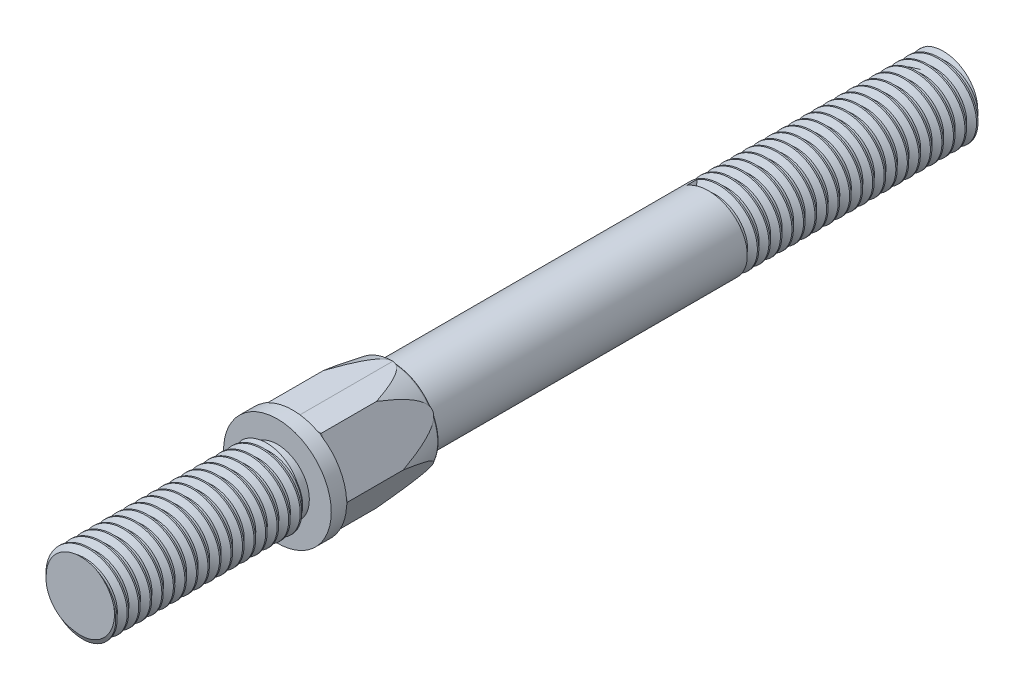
SolidWorks part; units mm, degrees
ref_plane "Front Plane" through (0, 0, 0) normal (0, 0, 1) x (1, 0, 0)
ref_plane "Top Plane" through (0, 0, 0) normal (0, 1, 0) x (1, 0, 0)
ref_plane "Right Plane" through (0, 0, 0) normal (1, 0, 0) x (0, 0, -1)
sketch "Sketch1" plane through (0, 0, 0) normal (1, 0, 0) x (0, 0, -1)
  line L0 (0, 0) -> (113, 0) construction
  line L6 (35, 7) -> (26, 7)
  line L7 (26, 7) -> (26, 4.9)
  line L8 (26, 4.9) -> (0, 4.9) construction
  line L9 (0, 4.9) -> (0, 0)
  line L10 (0, 0) -> (104, 0) construction
  line L11 (35, 7) -> (37, 7) construction
  line L12 (37, 7) -> (37, 6) construction
  line L14 (41, 4.9) -> (113, 4.9)
  line L17 (113, 4.9) -> (113, 0)
  line L21 (37, 6) -> (41, 6) construction
  line L23 (41, 4.9) -> (41, 6)
  line L24 (35, 7) -> (41, 6)
  line L25 (0, 0) -> (113, 0)
  line L26 (26, 4.9) -> (26, 4.15)
  line L27 (26, 4.15) -> (25, 4.15)
  line L28 (25, 4.15) -> (25, 4.9)
  line L29 (25, 4.9) -> (0, 4.9)
revolve "Revolve1" add sketch "Sketch1" angle 360 about L0
sketch "Sketch8" plane through (0, 0, -41) normal (0, 0, -1) x (-1, 0, 0)
  line L1 (-3.4641, 6) -> (-6.9282, 0)
  line L2 (-6.9282, 0) -> (-3.4641, -6)
  line L3 (-3.4641, -6) -> (3.4641, -6)
  line L4 (3.4641, -6) -> (6.9282, 0)
  line L5 (6.9282, 0) -> (3.4641, 6)
  line L6 (3.4641, 6) -> (-3.4641, 6)
  circle A1 centre (0, 0) radius 7 construction
  circle A2 centre (0, 0) radius 6 construction
  dimension "D1" = 12
extrude "Cut-Extrude1" cut sketch "Sketch8" against normal blind 13 flip side to cut
fillet "Fillet1" radius 0.25 13 edges at (-4.3301, 4.5, -28) (-6.0622, 1.5, -28) (-5.1962, -3, -28) (0, -6, -28) (5.1962, -3, -28) (-1.7321, 6, -28) (1.7321, 6, -28) (5.1962, 3, -28) (-3, -5.1962, -41) (-6, 0, -41) (6, 0, -41) (3, 5.1962, -41) (3, -5.1962, -41)
thread "Thread1" pitch 1.5 start angle 0, offset 2, length 32, pitch 1.5, diameter 9.8
ref_plane "Plane1" through (4.9, 0, -115) normal (0, -1, 0) x (1, 0, 0)
sketch "Thread Profile1" plane through (4.9, 0, -115) normal (0, -1, 0) x (1, 0, 0)
  line L0 (0, 0) -> (0, 1.5) construction
  line L11 (0, 0) -> (0, 1.3125)
  line L12 (0, 1.3125) -> (-0.8119, 0.8437)
  line L13 (-0.8119, 0.8437) -> (-0.8119, 0.4687)
  line L15 (-0.8119, 0.4687) -> (0, 0)
  line L17 (-0.8119, 0.6562) -> (0, 0.6562) construction
  point P2 (0, 0)
  dimension "Pitch" = 1.5
  dimension "Profile_Angle" = 60
  dimension "Profile_Land" = 0.375
  dimension "Profile_Height" = 0.8119
thread "Thread2" pitch 1.5 start angle 0, offset 2, length 0, pitch 1.5, diameter 9.8
ref_plane "Plane2" through (-4.9, 0, 2) normal (0, -1, 0) x (-1, 0, 0)
sketch "Thread Profile2" plane through (-4.9, 0, 2) normal (0, -1, 0) x (-1, 0, 0)
  line L0 (0, 0) -> (0, 1.5) construction
  line L11 (0, 0) -> (0, 1.3125)
  line L12 (0, 1.3125) -> (-0.8119, 0.8437)
  line L13 (-0.8119, 0.8437) -> (-0.8119, 0.4687)
  line L15 (-0.8119, 0.4687) -> (0, 0)
  line L17 (-0.8119, 0.6562) -> (0, 0.6562) construction
  point P2 (0, 0)
  dimension "Pitch" = 1.5
  dimension "Profile_Angle" = 60
  dimension "Profile_Land" = 0.375
  dimension "Profile_Height" = 0.8119
chamfer "Chamfer1" distance 0.1 angle 45 1 edges at (4.9, 0, -41)
equation "\"D1@Sketch1\"=\"D2@Sketch1\""
equation "\"D2@Sketch1\"=9.8/2"
